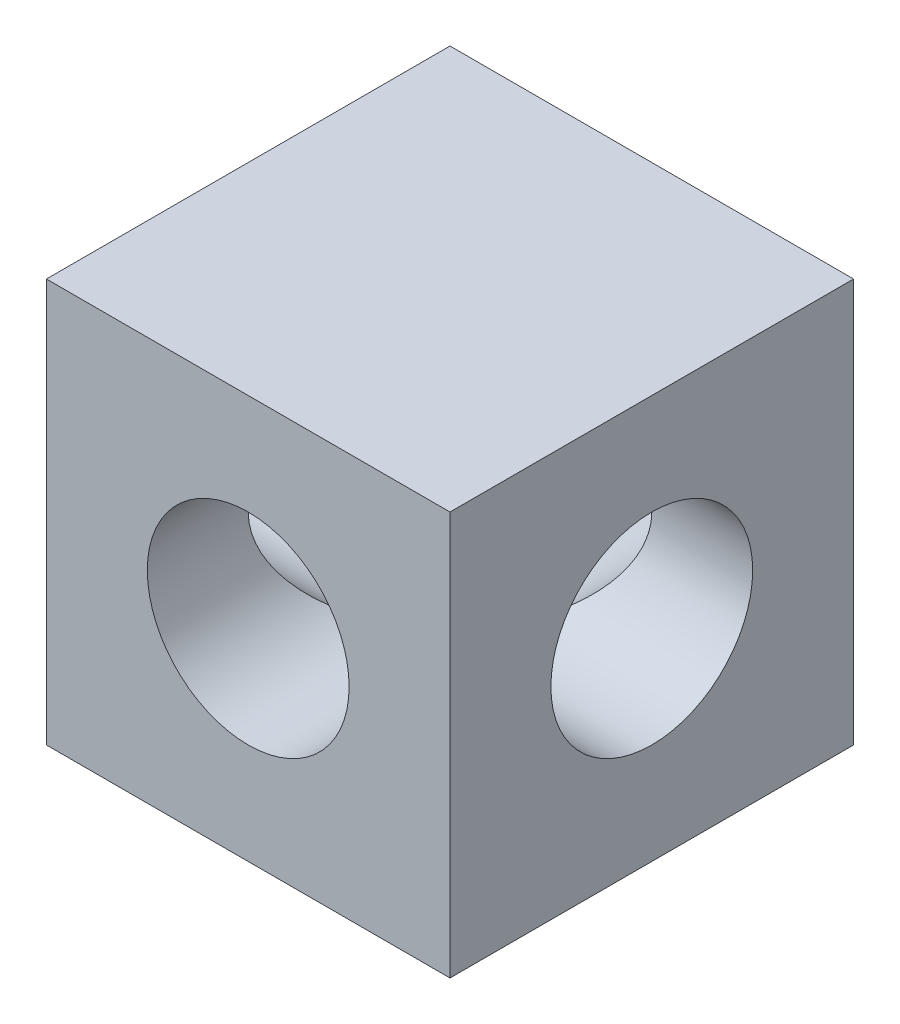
SolidWorks part; units mm, degrees
ref_plane "Ebene vorne" through (0, 0, 0) normal (0, 0, 1) x (1, 0, 0)
ref_plane "Ebene oben" through (0, 0, 0) normal (0, 1, 0) x (1, 0, 0)
ref_plane "Ebene rechts" through (0, 0, 0) normal (1, 0, 0) x (0, 0, -1)
ref_plane "Ebene1" through (0, 0.5679, 0) normal (0, -1, 0) x (1, 0, 0)
sketch "Skizze1" plane through (0, 0.5679, 0) normal (0, -1, 0) x (1, 0, 0)
  line L0 (-9.5, -9.5) -> (9.5, -9.5)
  line L1 (9.5, -9.5) -> (9.5, 9.5)
  line L2 (9.5, 9.5) -> (-9.5, 9.5)
  line L3 (-9.5, 9.5) -> (-9.5, -9.5)
  line L4 (-9.5, -9.5) -> (9.5, 9.5) construction
  point P4 (0, 0)
  dimension "D1" = 19
  dimension "D2" = 19
extrude "Linear austragen1" add sketch "Skizze1" against normal mid plane 19
sketch "Skizze2" plane through (0, 0, 0) normal (0, 0, 1) x (1, 0, 0)
  line L0 (-9.5, 5.3179) -> (-9.5, 0.5679)
  line L1 (-9.5, 0.5679) -> (9.5, 0.5679)
  line L2 (9.5, 0.5679) -> (9.5, 5.3179)
  line L3 (9.5, 5.3179) -> (-9.5, 5.3179)
  line L4 (-9.5, 0.5679) -> (9.5, 0.5679) construction
  line L5 (-29.2531, 0.5679) -> (9.5, 0.5679) construction
  line L6 (9.5, 10.0679) -> (9.5, -8.9321) construction
  line L7 (-9.5, 10.0679) -> (-9.5, -8.9321) construction
  dimension "D1" = 9.5
revolve "Schnitt-Rotation1" cut sketch "Skizze2" angle 360 about L4
hole_wizard "Bohrung1" positions "Skizze4" profile "Skizze3" legacy
sketch "Skizze4" plane through (0, 0, -9.5) normal (0, 0, -1) x (-1, 0, 0)
  line L0 (9.5, -8.9321) -> (-9.5, 10.0679) construction
  point P0 (0, 0.5679)
sketch "Skizze3" plane through (0, 0.5679, -9.5) normal (1, 0, 0) x (0, 1, 0)
  line L0 (0, 0) -> (0, 19)
  line L1 (0, 19) -> (4.75, 19)
  line L2 (4.75, 19) -> (4.75, 0)
  line L3 (4.75, 0) -> (0, 0)
  line L4 (0, 110) -> (0, -10) construction
  dimension "Durchmesser" = 9.5
  dimension "Tiefe" = 19
